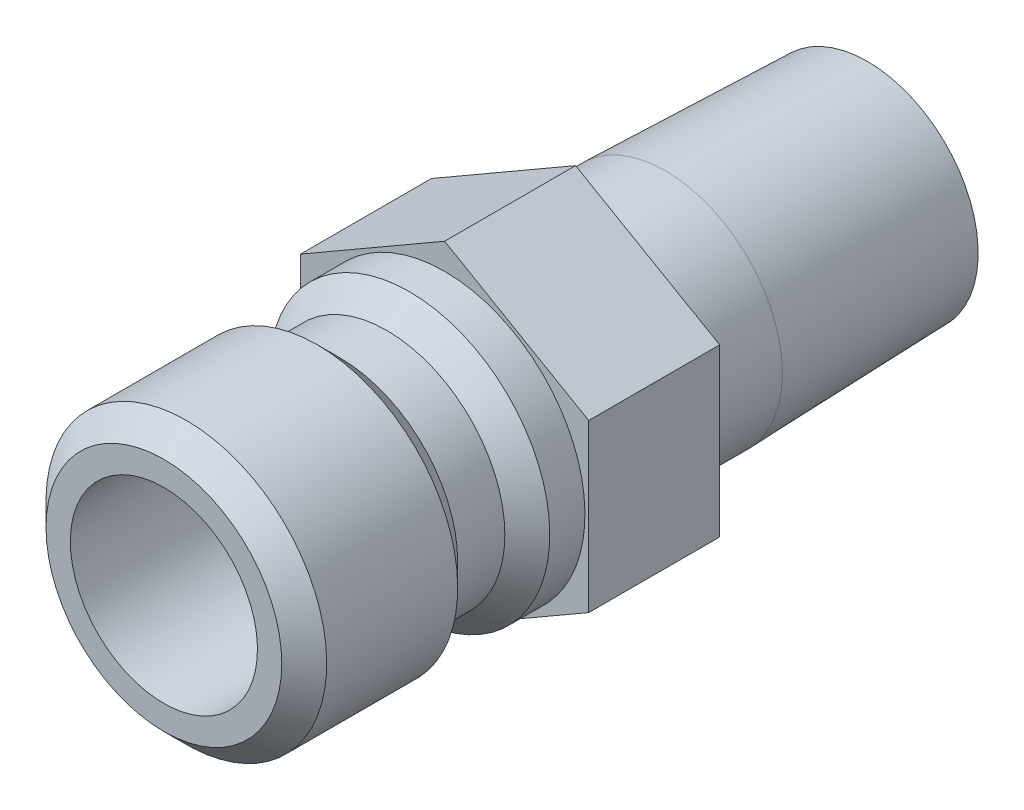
SolidWorks part; units mm, degrees
ref_plane "Front Plane" through (0, 0, 0) normal (0, 0, 1) x (1, 0, 0)
ref_plane "Top Plane" through (0, 0, 0) normal (0, 1, 0) x (1, 0, 0)
ref_plane "Right Plane" through (0, 0, 0) normal (1, 0, 0) x (0, 0, -1)
sketch "Sketch1" plane through (0, 0, 0) normal (1, 0, 0) x (0, 0, -1)
  line L0 (0, 0) -> (-12.7, 0) construction
  line L1 (-9.525, 3.175) -> (-9.525, 4.0005)
  line L2 (-3.556, 4.0005) -> (-3.556, 0) construction
  line L3 (-8.763, 4.7625) -> (-4.318, 4.7625)
  line L4 (0, 3.9688) -> (0, 0) construction
  line L5 (-3.556, 4.0005) -> (-1.9558, 4.0005)
  line L6 (-1.1938, 4.7625) -> (0, 4.7625)
  line L7 (0, 4.7625) -> (0, 3.9688)
  line L8 (-3.556, 4.0005) -> (-4.318, 4.7625)
  line L9 (-1.9558, 4.0005) -> (-1.1938, 4.7625)
  line L10 (-9.525, 4.0005) -> (-8.763, 4.7625)
  line L11 (-9.525, 3.175) -> (0.127, 3.175)
  line L12 (0, 3.9688) -> (7.493, 3.9688)
  line L13 (7.493, 3.9688) -> (14.351, 3.7544)
  line L14 (14.351, 3.7544) -> (14.351, 2.3813)
  line L15 (0, 0) -> (4.445, 0) construction
  line L16 (0.127, 3.175) -> (0.127, 2.3813)
  line L17 (0.127, 2.3813) -> (14.351, 2.3813)
  dimension "D1" = 9.525
  dimension "D2" = 1.6002
  dimension "D3" = 0.762
  dimension "D4" = 45
  dimension "D5" = 5.969
  dimension "D6" = 45
  dimension "D7" = 1.79
  dimension "D8" = 6.858
  dimension "D9" = 23.876
  dimension "D10" = 3.175
  dimension "D11" = 4.445
  dimension "D12" = 6.35
  dimension "D13" = 9.652
  dimension "D14" = 9.525
  dimension "D15" = 7.9375
  dimension "D16" = 4.7625
revolve "Revolve1" add sketch "Sketch1" angle 360 about L0
sketch "Sketch2" plane through (0, 0, 0) normal (0, 0, 1) x (1, 0, 0)
  line L1 (-4.8895, 2.823) -> (-4.8895, -2.823)
  line L2 (-4.8895, -2.823) -> (0, -5.6459)
  line L3 (0, -5.6459) -> (4.8895, -2.823)
  line L4 (4.8895, -2.823) -> (4.8895, 2.823)
  line L5 (4.8895, 2.823) -> (0, 5.6459)
  line L6 (0, 5.6459) -> (-4.8895, 2.823)
  circle A0 centre (0, 0) radius 4.8895 construction
  circle A1 centre (0, 0) radius 3.175 construction
  circle A2 centre (0, 0) radius 3.175
  dimension "D1" = 9.779
extrude "Boss-Extrude1" add sketch "Sketch2" against normal up to vertex (4.445 mm away)
